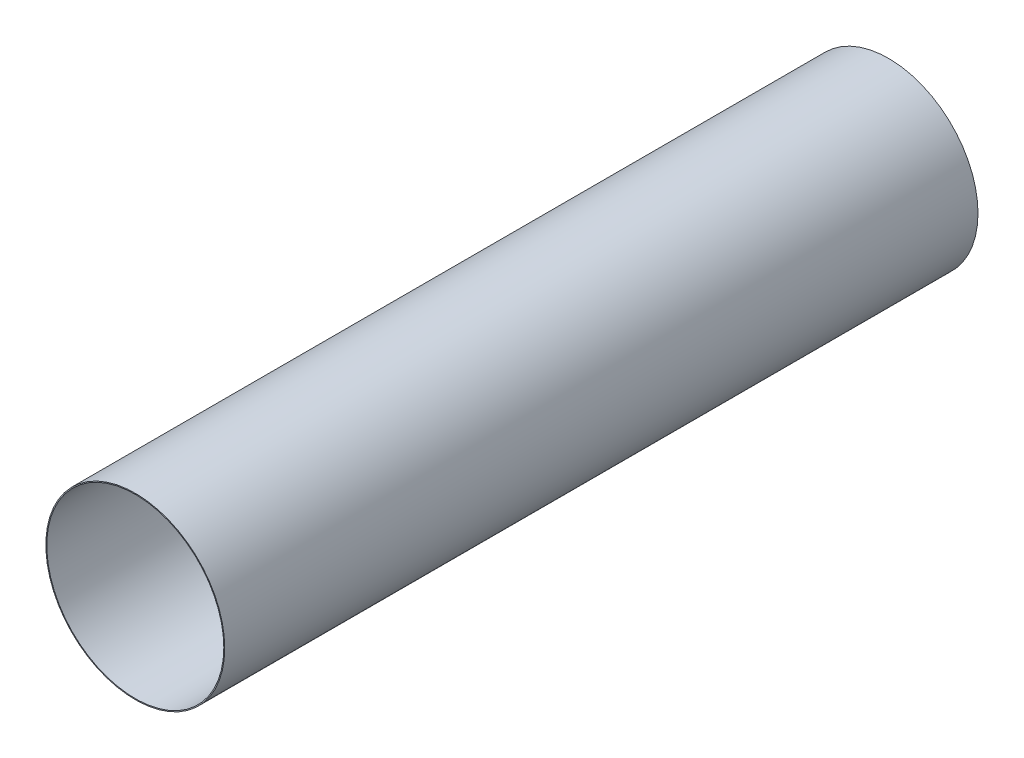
SolidWorks part; units mm, degrees
ref_plane "Front Plane" through (0, 0, 0) normal (0, 0, 1) x (1, 0, 0)
ref_plane "Top Plane" through (0, 0, 0) normal (0, 1, 0) x (1, 0, 0)
ref_plane "Right Plane" through (0, 0, 0) normal (1, 0, 0) x (0, 0, -1)
sketch "Sketch1" plane through (0, 0, 0) normal (0, 0, 1) x (1, 0, 0)
  circle A0 centre (0, 0) radius 19
  circle A1 centre (0, 0) radius 18.8
  dimension "D1" = 0.2
  dimension "D2" = 38
extrude "Boss-Extrude1" add sketch "Sketch1" along normal mid plane 160
